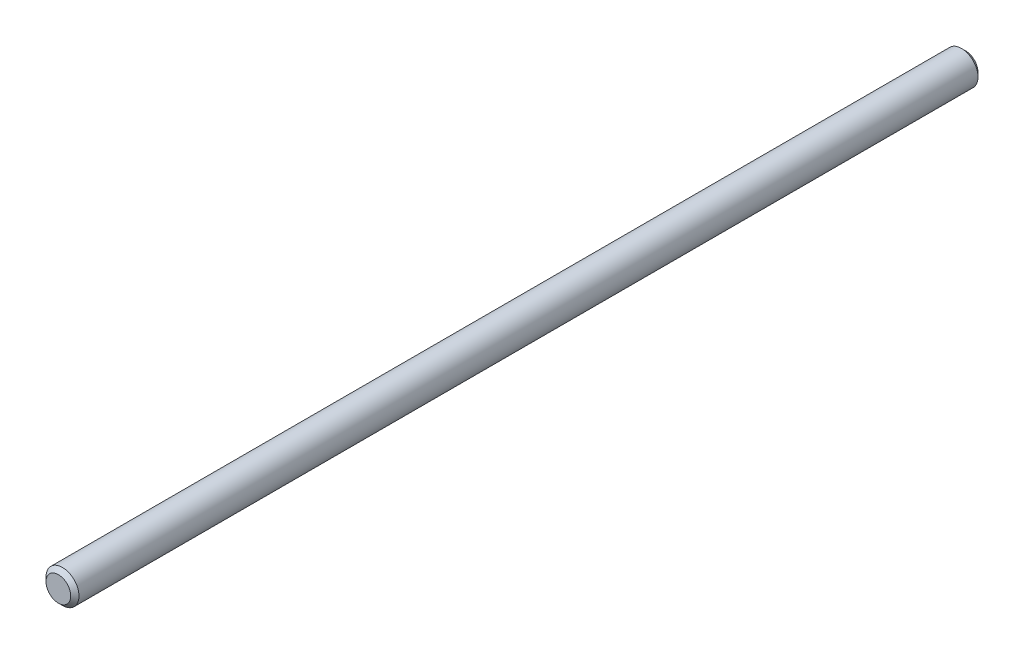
SolidWorks part; units mm, degrees
ref_plane "前视基准面" through (0, 0, 0) normal (0, 0, 1) x (1, 0, 0)
ref_plane "上视基准面" through (0, 0, 0) normal (0, 1, 0) x (1, 0, 0)
ref_plane "右视基准面" through (0, 0, 0) normal (1, 0, 0) x (0, 0, -1)
sketch "草图1" plane through (0, 0, 0) normal (0, 0, 1) x (1, 0, 0)
  circle A0 centre (0, 0) radius 2
extrude "凸台-拉伸1" add sketch "草图1" against normal blind 110
chamfer "倒角1" distance 0.5 angle 45 2 edges at (2, 0, -110) (2, 0, 0)
